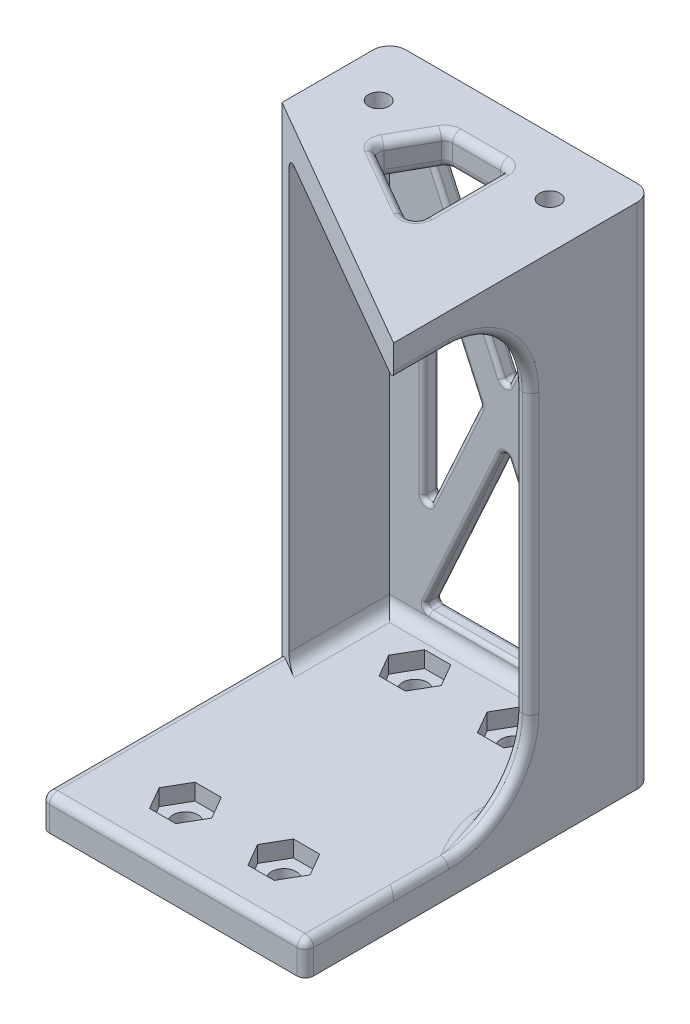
SolidWorks part; units mm, degrees
ref_plane "Front Plane" through (0, 0, 0) normal (0, 0, 1) x (1, 0, 0)
ref_plane "Top Plane" through (0, 0, 0) normal (0, 1, 0) x (1, 0, 0)
ref_plane "Right Plane" through (0, 0, 0) normal (1, 0, 0) x (0, 0, -1)
sketch "Sketch1" plane through (0, 0, 0) normal (0, 1, 0) x (1, 0, 0)
  line L1 (0, 0) -> (32.2, 0)
  line L2 (0, 0) -> (0, 34.25)
  line L3 (0, 34.25) -> (32.2, 34.25)
  line L4 (32.2, 0) -> (32.2, 34.25)
  dimension "D1" = 34.25
  dimension "D2" = 32.2
extrude "Boss-Extrude1" add sketch "Sketch1" along normal blind 4
sketch "Sketch2" plane through (0, 4, 0) normal (0, 1, 0) x (1, 0, 0)
  line L0 (32.2, 34.25) -> (0, 34.25) construction
  line L3 (16.1, 27.25) -> (10.1, 27.25) construction
  line L4 (16.1, 27.25) -> (22.1, 27.25) construction
  line L5 (16.1, 34.25) -> (16.1, 0) construction
  line L6 (0, 0) -> (32.2, 0) construction
  dimension "D1" = 6
  dimension "D2" = 7
ref_plane "Plane1" through (0, 58, 0) normal (0, 1, 0) x (1, 0, 0)
sketch "Sketch5" plane through (0, 58, 0) normal (0, 1, 0) x (1, 0, 0)
  line L1 (0, 34.25) -> (32.2, 34.25)
  line L2 (0, 34.25) -> (0, 0)
  line L3 (0, 0) -> (32.2, 0)
  line L4 (32.2, 34.25) -> (32.2, 0)
  dimension "D1" = 34.25
extrude "Boss-Extrude2" add sketch "Sketch5" along normal blind 4 separate body
sketch "Sketch6" plane through (0, 62, 0) normal (0, 1, 0) x (1, 0, 0)
  line L0 (16.1, 34.25) -> (16.1, 0) construction
  line L1 (32.2, 34.25) -> (0, 34.25) construction
  line L2 (0, 0) -> (32.2, 0) construction
  line L3 (16.1, 27.25) -> (5.67, 27.25) construction
  line L4 (16.1, 27.25) -> (26.53, 27.25) construction
  dimension "D1" = 10.43
  dimension "D2" = 7
sketch "Sketch11" plane through (0, 0, 0) normal (-1, 0, 0) x (0, 0, 1)
  line L0 (-34.25, 4) -> (-34.25, 58)
  line L1 (-34.25, 58) -> (0, 58)
  line L2 (0, 58) -> (0, 4)
  line L3 (0, 4) -> (-34.25, 4)
  line L4 (-34.25, 31) -> (0, 31) construction
extrude "Boss-Extrude3" add sketch "Sketch11" against normal blind 2
sketch "Sketch24" plane through (0, 0, 0) normal (0, -1, 0) x (1, 0, 0)
  line L0 (16.1, -34.25) -> (16.1, 71.9) construction
  line L1 (108.0286, 41.2361) -> (-3.3086, -23.0444)
  line L2 (108.0286, 18.825) -> (108.0286, 124.975) construction
  line L3 (108.0286, 124.975) -> (16.1, 178.05) construction
  line L4 (16.1, 178.05) -> (-75.8286, 124.975) construction
  line L5 (-75.8286, 124.975) -> (-75.8286, 18.825) construction
  line L6 (-75.8286, 18.825) -> (16.1, -34.25) construction
  line L7 (16.1, -34.25) -> (108.0286, 18.825) construction
  line L8 (-3.3086, -23.0444) -> (-39.5686, 39.7597)
  line L9 (108.0286, 41.2361) -> (71.7686, 104.0403)
  line L10 (-39.5686, 39.7597) -> (71.7686, 104.0403)
  circle A0 centre (16.1, 71.9) radius 91.9286 construction
  dimension "D1" = 106.15
  dimension "D2" = 72.52
extrude "Cut-Extrude6" cut sketch "Sketch24" against normal through all
sketch "Sketch26" plane through (32.2, 0, 0) normal (1, 0, 0) x (0, 0, -1)
  line L0 (34.25, 4) -> (34.25, 58)
  line L1 (34.25, 58) -> (2.5435, 58)
  line L2 (2.5435, 58) -> (2.5435, 4)
  line L3 (2.5435, 4) -> (34.25, 4)
extrude "Boss-Extrude5" add sketch "Sketch26" against normal blind 2
sketch "Sketch27" plane through (0, 58, 0) normal (0, 1, 0) x (1, 0, 0)
  line L3 (32.2, 2.5435) -> (30.2, 3.6982)
  line L4 (30.2, 3.6982) -> (30.2, 2.5435)
  line L5 (30.2, 2.5435) -> (32.2, 2.5435)
  line L6 (32.2, 2.5435) -> (30.2, 3.6982)
  line L7 (30.2, 3.6982) -> (30.2, 2.5435)
  line L8 (30.2, 2.5435) -> (32.2, 2.5435)
  dimension "D1" = 0
extrude "Cut-Extrude7" cut sketch "Sketch27" against normal through all
sketch "Sketch28" plane through (32.2, 0, 0) normal (1, 0, 0) x (0, 0, -1)
  line L3 (2.5435, 62) -> (2.5435, 0) construction
  line L7 (19.25, 4) -> (19.25, 58)
  line L8 (19.25, 58) -> (2.5435, 58)
  line L9 (2.5435, 62) -> (34.25, 62) construction
  line L10 (34.25, 0) -> (34.25, 62) construction
  line L11 (2.5435, 0) -> (34.25, 0) construction
  line L12 (19.25, 4) -> (2.5435, 4)
  line L13 (2.5435, 4) -> (2.5435, 58)
  dimension "D1" = 4
  dimension "D4" = 4
  dimension "D6" = 15
extrude "Cut-Extrude8" cut sketch "Sketch28" against normal up to next
sketch "Sketch29" plane through (0, 62, 0) normal (0, 1, 0) x (1, 0, 0)
  line L0 (20.53, 16.2094) -> (9.824, 22.3905)
  line L1 (9.824, 22.3905) -> (13.1097, 28.25)
  line L2 (13.1097, 28.25) -> (20.53, 28.25)
  line L3 (20.53, 28.25) -> (20.53, 16.2094)
  line L4 (32.2, 2.5435) -> (0, 21.1342) construction
  line L5 (32.2, 34.25) -> (0, 34.25) construction
  dimension "D1" = 6
  dimension "D2" = 6
  dimension "D3" = 6
  dimension "D4" = 6
extrude "Cut-Extrude9" cut sketch "Sketch29" against normal up to next
fillet "Fillet2" radius 2 2 edges at (32.2, 31, -34.25) (0, 31, -34.25)
sketch "Sketch31" plane through (2, 0, 0) normal (1, 0, 0) x (0, 0, -1)
  line L0 (34.25, 4) -> (34.25, 58)
  line L1 (34.25, 58) -> (32.25, 58)
  line L2 (19.9795, 58) -> (34.25, 58) construction
  line L3 (32.25, 58) -> (32.25, 4)
  line L4 (34.25, 4) -> (19.9795, 4) construction
  line L5 (32.25, 4) -> (34.25, 4)
  dimension "D1" = 2
extrude "Boss-Extrude6" add sketch "Sketch31" along normal up to next
sketch "Sketch32" plane through (0, 0, -34.25) normal (0, 0, -1) x (-1, 0, 0)
  line L0 (-16.1, 62) -> (-16.1, 0) construction
  line L1 (-30.2, 62) -> (-2, 62) construction
  line L2 (-30.2, 0) -> (-2, 0) construction
  line L3 (-32.2, 31) -> (0, 31) construction
  line L4 (-32.2, 0) -> (-32.2, 62) construction
  line L5 (0, 62) -> (0, 0) construction
  line L6 (-6.0935, 56) -> (-26.1065, 56)
  line L7 (-26.1065, 56) -> (-16.1, 34)
  line L9 (-30.2, 62) -> (-2, 0) construction
  line L10 (-6.0935, 56) -> (-16.1, 34)
  line L11 (-6.0935, 6) -> (-16.1, 28)
  line L12 (-6.0935, 6) -> (-26.1065, 6)
  line L13 (-26.1065, 6) -> (-16.1, 28)
  line L14 (-6.0935, 46.4043) -> (-6.0935, 15.5957)
  line L15 (-6.0935, 46.4043) -> (-13.1, 31)
  line L17 (-6.0935, 15.5957) -> (-13.1, 31)
  line L18 (-26.1065, 46.4043) -> (-26.1065, 15.5957)
  line L19 (-26.1065, 46.4043) -> (-19.1, 31)
  line L20 (-26.1065, 15.5957) -> (-19.1, 31)
  point P14 (-16.1, 31)
  point P29 (-6.0935, 31)
  dimension "D1" = 6
  dimension "D2" = 3
  dimension "D3" = 3
extrude "Cut-Extrude11" cut sketch "Sketch32" against normal up to next
fillet "Fillet3" radius 0.5 36 edges at (9.5968, 38.7021, -32.25) (9.5968, 38.7021, -34.25) (9.5968, 23.2979, -34.25) (9.5968, 23.2979, -32.25) (22.6032, 23.2979, -32.25) (22.6032, 23.2979, -34.25) (22.6032, 38.7021, -34.25) (22.6032, 38.7021, -32.25) (21.1032, 45, -32.25) (21.1032, 45, -34.25) (11.0968, 45, -34.25) (11.0968, 45, -32.25) (11.0968, 17, -32.25) (11.0968, 17, -34.25) (21.1032, 17, -34.25) (21.1032, 17, -32.25) (6.0935, 46.4043, -33.25) (6.0935, 31, -34.25) (6.0935, 15.5957, -33.25) (6.0935, 31, -32.25) (26.1065, 15.5957, -33.25) (26.1065, 31, -34.25) (26.1065, 46.4043, -33.25) (26.1065, 31, -32.25) (26.1065, 56, -33.25) (16.1, 56, -34.25) (6.0935, 56, -33.25) (16.1, 56, -32.25) (6.0935, 6, -33.25) (16.1, 6, -34.25) (26.1065, 6, -33.25) (16.1, 6, -32.25) (19.1, 31, -33.25) (13.1, 31, -33.25) (16.1, 34, -33.25) (16.1, 28, -33.25)
fillet "Fillet4" radius 10 2 edges at (31.2, 58, -19.25) (31.2, 4, -19.25)
fillet "Fillet5" radius 1 8 edges at (32.2, 58, -5.8968) (32.2, 55.0711, -16.3211) (32.2, 31, -19.25) (32.2, 6.9289, -16.3211) (32.2, 4, -5.8968) (30.2, 55.0711, -16.3211) (30.2, 31, -19.25) (30.2, 6.9289, -16.3211)
sketch "Sketch35" plane through (0, 4, 0) normal (0, 1, 0) x (1, 0, 0)
  line L1 (13.3043, 27.25) -> (11.7021, 30.025)
  line L2 (11.7021, 30.025) -> (8.4979, 30.025)
  line L3 (8.4979, 30.025) -> (6.8957, 27.25)
  line L4 (6.8957, 27.25) -> (8.4979, 24.475)
  line L5 (8.4979, 24.475) -> (11.7021, 24.475)
  line L6 (11.7021, 24.475) -> (13.3043, 27.25)
  line L7 (18.8957, 27.25) -> (20.4979, 24.475)
  line L8 (20.4979, 24.475) -> (23.7021, 24.475)
  line L9 (23.7021, 24.475) -> (25.3043, 27.25)
  line L10 (25.3043, 27.25) -> (23.7021, 30.025)
  line L11 (23.7021, 30.025) -> (20.4979, 30.025)
  line L12 (20.4979, 30.025) -> (18.8957, 27.25)
  line L14 (30.2, 34.25) -> (2, 34.25) construction
  circle A0 centre (10.1, 27.25) radius 2.775 construction
  circle A1 centre (22.1, 27.25) radius 2.775 construction
  dimension "D1" = 5.55
extrude "Cut-Extrude14" cut sketch "Sketch35" against normal blind 2
fillet "Fillet6" radius 1.5 8 edges at (30.4594, 58, -11.8326) (30.4594, 4, -11.8326) (2, 58, -26.1148) (16.1, 58, -32.25) (30.2, 58, -23.0413) (30.2, 4, -23.0413) (16.1, 4, -32.25) (2, 4, -26.1148)
sketch "Sketch37" plane through (0, 4, 0) normal (0, 1, 0) x (1, 0, 0)
  circle A0 centre (10.1, 27.25) radius 1.5
  circle A1 centre (22.1, 27.25) radius 1.5
  dimension "D1" = 3
extrude "Cut-Extrude15" cut sketch "Sketch37" against normal blind 10
sketch "Sketch38" plane through (0, 62, 0) normal (0, 1, 0) x (1, 0, 0)
  circle A0 centre (5.67, 27.25) radius 1.25
  circle A1 centre (26.53, 27.25) radius 1.25
  dimension "D1" = 2.5
extrude "Cut-Extrude16" cut sketch "Sketch38" against normal up to next
sketch "Sketch39" plane through (0, 0, 0) normal (0, -1, 0) x (1, 0, 0)
  line L0 (0, -21.1342) -> (0, 8.2337)
  line L1 (0, 8.2337) -> (32.2, 8.2337)
  line L2 (32.2, 8.2337) -> (32.2, -2.5435)
  line L3 (32.2, -2.5435) -> (0, -21.1342)
  line L4 (16.1, -27.25) -> (16.1, 0.75) construction
  line L5 (16.1, 0.75) -> (10.1, 0.75) construction
  line L6 (16.1, 0.75) -> (22.1, 0.75) construction
  line L7 (16.1, -27.25) -> (10.1, -27.25) construction
  circle A0 centre (10.1, 0.75) radius 1.5
  circle A1 centre (22.1, 0.75) radius 1.5
  circle A2 centre (10.1, -27.25) radius 1.5 construction
  dimension "D1" = 28
extrude "Boss-Extrude7" add sketch "Sketch39" against normal blind 4
fillet "Fillet7" radius 1 5 edges at (32.2, 4, 2.8451) (0, 4, -6.4503) (0, 2, 8.2337) (32.2, 2, 8.2337) (16.1, 4, 8.2337)
sketch "Sketch40" plane through (0, 4, 0) normal (0, 1, 0) x (1, 0, 0)
  line L0 (1, -7.2337) -> (31.2, -7.2337) construction
  line L1 (8.4979, -3.525) -> (11.7021, -3.525)
  line L2 (11.7021, -3.525) -> (13.3043, -0.75)
  line L3 (13.3043, -0.75) -> (11.7021, 2.025)
  line L4 (11.7021, 2.025) -> (8.4979, 2.025)
  line L5 (8.4979, 2.025) -> (6.8957, -0.75)
  line L6 (6.8957, -0.75) -> (8.4979, -3.525)
  line L7 (20.4979, -3.525) -> (23.7021, -3.525)
  line L8 (23.7021, -3.525) -> (25.3043, -0.75)
  line L9 (25.3043, -0.75) -> (23.7021, 2.025)
  line L10 (23.7021, 2.025) -> (20.4979, 2.025)
  line L11 (20.4979, 2.025) -> (18.8957, -0.75)
  line L12 (18.8957, -0.75) -> (20.4979, -3.525)
  circle A0 centre (10.1, -0.75) radius 2.775 construction
  circle A1 centre (22.1, -0.75) radius 2.775 construction
  dimension "D1" = 5.55
extrude "Cut-Extrude17" cut sketch "Sketch40" against normal blind 2
fillet "Fillet8" radius 1 12 edges at (16.8199, 58, -28.25) (16.8199, 62, -28.25) (15.177, 62, -19.3) (15.177, 58, -19.3) (9.824, 60, -22.3905) (11.4669, 62, -25.3203) (13.1097, 60, -28.25) (11.4669, 58, -25.3203) (20.53, 60, -28.25) (20.53, 62, -22.2297) (20.53, 60, -16.2094) (20.53, 58, -22.2297)
